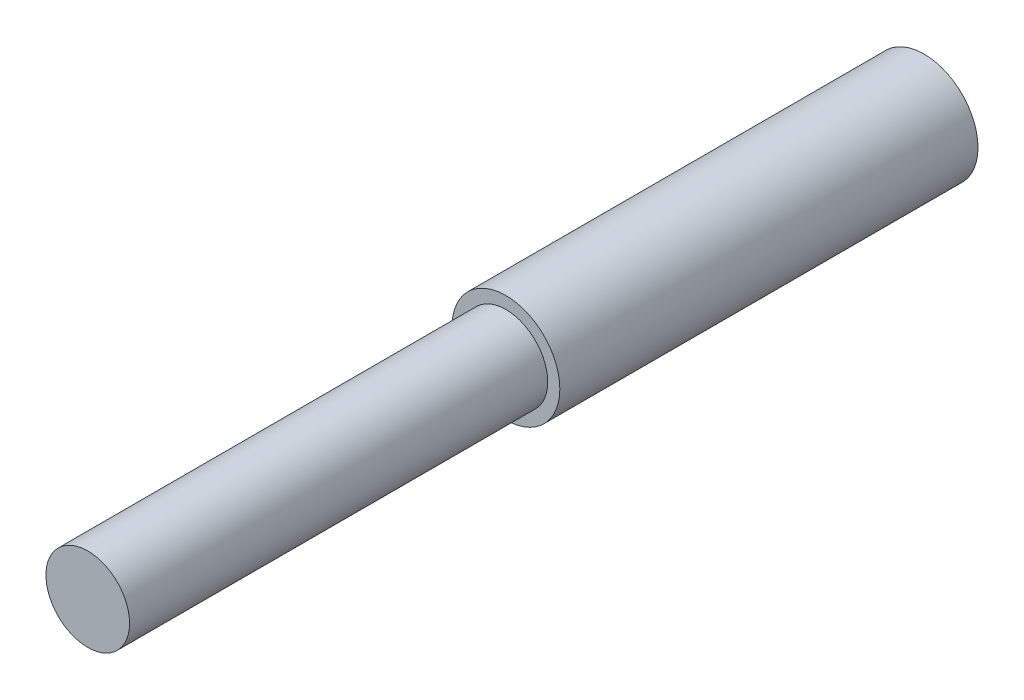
SolidWorks part; units mm, degrees
ref_plane "Front Plane" through (0, 0, 0) normal (0, 0, 1) x (1, 0, 0)
ref_plane "Top Plane" through (0, 0, 0) normal (0, 1, 0) x (1, 0, 0)
ref_plane "Right Plane" through (0, 0, 0) normal (1, 0, 0) x (0, 0, -1)
sketch "Sketch1" plane through (0, 0, 0) normal (0, 0, 1) x (1, 0, 0)
  circle A0 centre (0, 0) radius 6.223
  dimension "D1" = 12.446
extrude "Boss-Extrude1" add sketch "Sketch1" along normal blind 48.26
sketch "Sketch2" plane through (0, 0, 48.26) normal (0, 0, 1) x (1, 0, 0)
  circle A0 centre (0, 0) radius 4.826
  dimension "D1" = 9.652
extrude "Boss-Extrude2" add sketch "Sketch2" along normal blind 48.26
